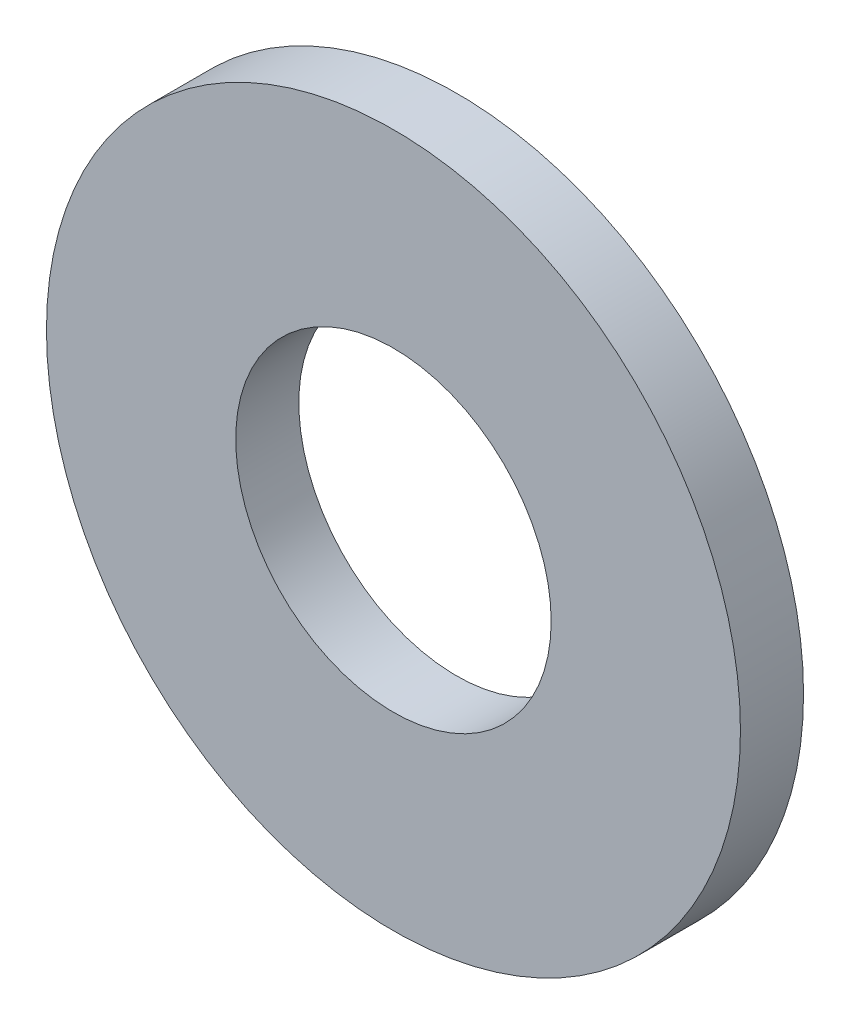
SolidWorks part; units mm, degrees
ref_plane "Face" through (0, 0, 0) normal (0, 0, 1) x (1, 0, 0)
ref_plane "Dessus" through (0, 0, 0) normal (0, 1, 0) x (1, 0, 0)
ref_plane "Droite" through (0, 0, 0) normal (1, 0, 0) x (0, 0, -1)
sketch "Esquisse1" plane through (0, 0, 0) normal (0, 0, 1) x (1, 0, 0)
  circle A0 centre (0, 0) radius 11
  circle A1 centre (0, 0) radius 5
  dimension "D1" = 22
  dimension "D2" = 10
extrude "Extrusion1" add sketch "Esquisse1" along normal blind 2
